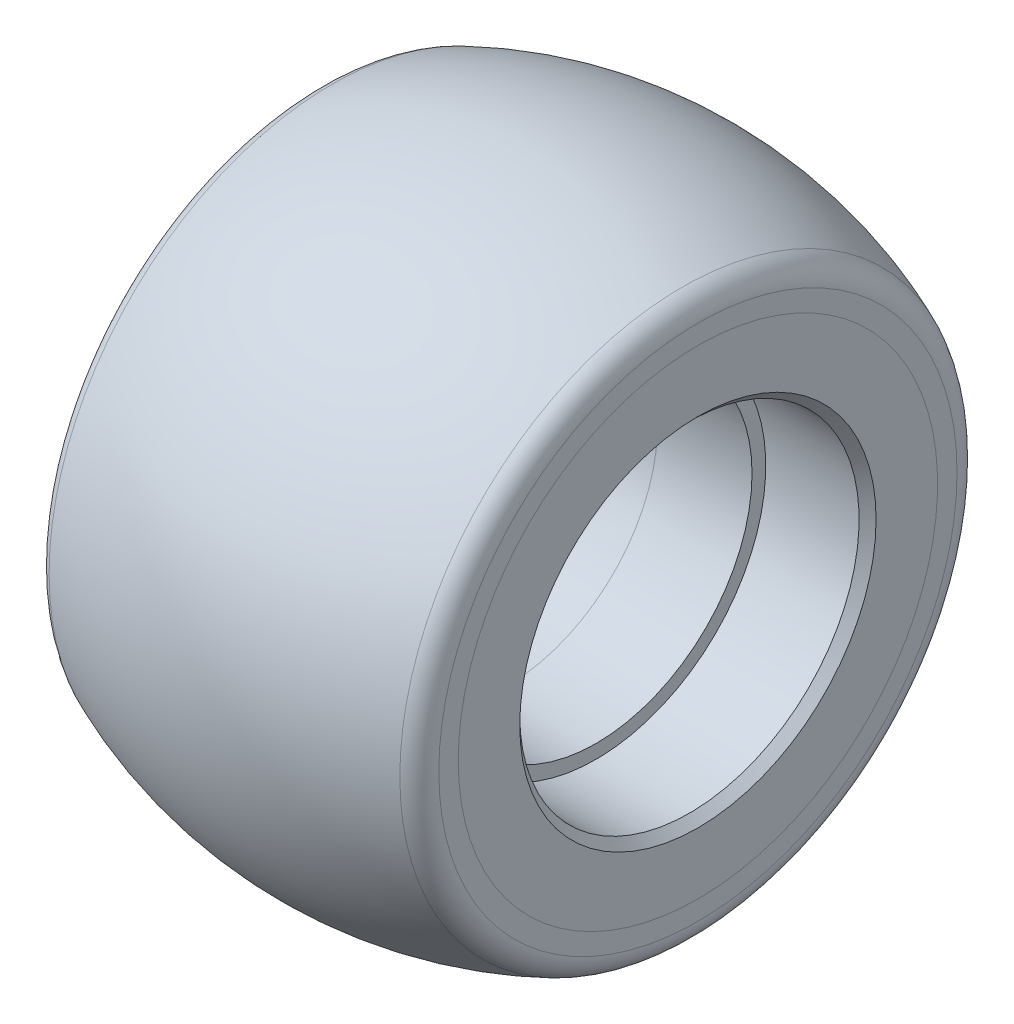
SolidWorks part; units mm, degrees
ref_plane "前视基准面" through (0, 0, 0) normal (0, 0, 1) x (1, 0, 0)
ref_plane "上视基准面" through (0, 0, 0) normal (0, 1, 0) x (1, 0, 0)
ref_plane "右视基准面" through (0, 0, 0) normal (1, 0, 0) x (0, 0, -1)
sketch "草图1" plane through (0, 0, 0) normal (0, 1, 0) x (1, 0, 0)
  line L0 (-26.3062, 0) -> (26.3062, 0) construction
  line L3 (22.5, 28.25) -> (0, 29.5)
  line L4 (21.5, 20) -> (22.5, 21)
  line L5 (10.5, 20) -> (21.5, 20)
  line L6 (0, 17.75) -> (10.5, 18.38)
  line L7 (-10.5, 18.38) -> (0, 17.75)
  line L8 (-21.5, 20) -> (-10.5, 20)
  line L9 (-22.5, 21) -> (-21.5, 20)
  line L10 (-22.5, 28.25) -> (-22.5, 21)
  line L11 (0, 29.5) -> (-22.5, 28.25)
  line L12 (22.5, 21) -> (22.5, 28.25)
  line L13 (10.5, 18.38) -> (10.5, 20)
  line L14 (-10.5, 20) -> (-10.5, 18.38)
revolve "旋转1" add sketch "草图1" angle 360 about L0
sketch "草图2" plane through (0, 0, 0) normal (0, 1, 0) x (1, 0, 0)
  line L0 (-26.3062, 0) -> (26.3062, 0) construction
  line L1 (22.5, 28.25) -> (22.5, 30.5407)
  line L2 (-22.5, 28.25) -> (-22.5, 30.5407)
  line L3 (22.5, 28.25) -> (0, 29.5)
  line L4 (0, 29.5) -> (-22.5, 28.25)
  arc A0 (20.67, 33.3032) -> (-20.67, 33.3032) centre (0, -15.5) ccw
  arc A1 (22.5, 30.5407) -> (20.67, 33.3032) centre (19.5, 30.5407) ccw
  arc A2 (-20.67, 33.3032) -> (-22.5, 30.5407) centre (-19.5, 30.5407) ccw
revolve "旋转2" add sketch "草图2" angle 360 about L0
